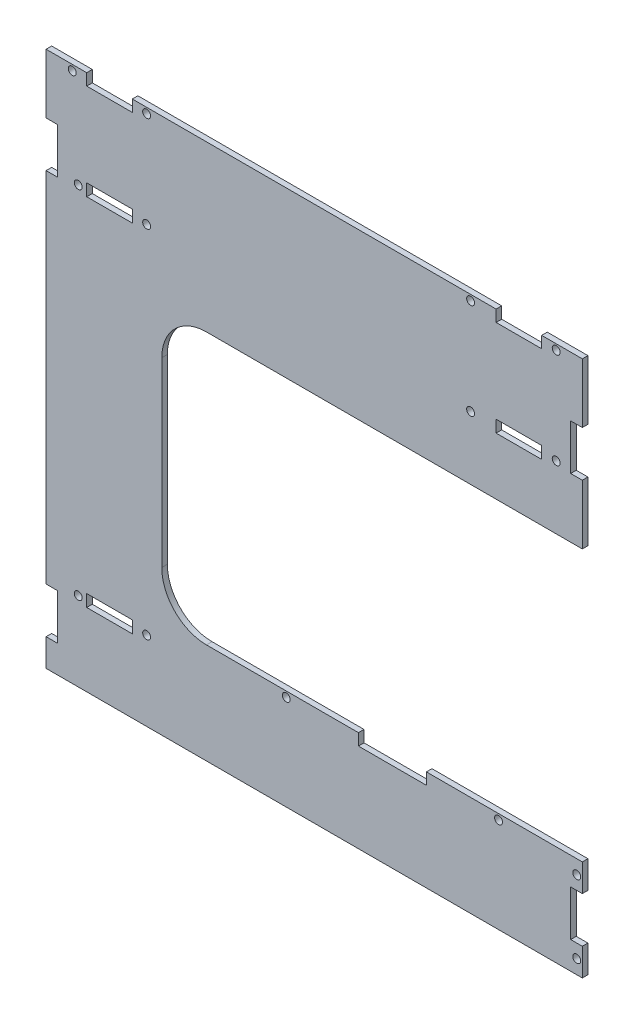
SolidWorks part; units mm, degrees
ref_plane "Front Plane" through (0, 0, 0) normal (0, 0, 1) x (1, 0, 0)
ref_plane "Top Plane" through (0, 0, 0) normal (0, 1, 0) x (1, 0, 0)
ref_plane "Right Plane" through (0, 0, 0) normal (1, 0, 0) x (0, 0, -1)
imported_body "Stock-H_bot printer-1"
sketch "Sketch1" plane through (0, 0, -304.8) normal (0, 0, -1) x (-1, 0, 0)
  line L0 (-281.45, 243.9758) -> (-256.05, 243.9758) construction
  line L1 (-281.45, 250.3258) -> (-281.45, 243.9758) construction
  line L2 (-256.05, 243.9758) -> (-256.05, 250.3258) construction
  line L3 (-256.05, 250.3258) -> (-281.45, 250.3258) construction
  line L4 (-281.45, 243.9758) -> (-256.05, 243.9758)
  line L5 (-281.45, 250.3258) -> (-281.45, 243.9758)
  line L6 (-256.05, 243.9758) -> (-256.05, 250.3258)
  line L7 (-256.05, 250.3258) -> (-281.45, 250.3258)
  line L8 (-48.75, 250.3258) -> (-48.75, 243.9758) construction
  line L9 (-23.35, 250.3258) -> (-48.75, 250.3258) construction
  line L10 (-23.35, 243.9758) -> (-23.35, 250.3258) construction
  line L11 (-48.75, 243.9758) -> (-23.35, 243.9758) construction
  line L12 (-48.75, 250.3258) -> (-48.75, 243.9758)
  line L13 (-23.35, 250.3258) -> (-48.75, 250.3258)
  line L14 (-23.35, 243.9758) -> (-23.35, 250.3258)
  line L15 (-48.75, 243.9758) -> (-23.35, 243.9758)
  line L16 (-48.75, 41.7902) -> (-23.35, 41.7902) construction
  line L17 (-23.35, 41.7902) -> (-23.35, 48.1402) construction
  line L18 (-23.35, 48.1402) -> (-48.75, 48.1402) construction
  line L19 (-48.75, 48.1402) -> (-48.75, 41.7902) construction
  line L20 (-48.75, 48.1402) -> (-48.75, 41.7902)
  line L21 (-23.35, 48.1402) -> (-48.75, 48.1402)
  line L22 (-23.35, 41.7902) -> (-23.35, 48.1402)
  line L23 (-48.75, 41.7902) -> (-23.35, 41.7902)
  line L24 (-304.8, 41.529) -> (-298.196, 41.529)
  line L25 (-298.196, 41.529) -> (-298.196, 15.621)
  line L26 (-298.196, 15.621) -> (-304.8, 15.621)
  line L27 (-304.8, 41.275) -> (-304.8, 41.529)
  line L28 (-304.8, 15.875) -> (-304.8, 15.621)
  line L29 (-177.546, 57.15) -> (-177.546, 50.546)
  line L30 (-177.546, 50.546) -> (-216.154, 50.546)
  line L31 (-216.154, 50.546) -> (-216.154, 57.15)
  line L32 (-216.154, 57.15) -> (-215.9, 57.15)
  line L33 (-177.8, 57.15) -> (-177.546, 57.15)
  line L34 (-49.004, 41.5362) -> (-23.096, 41.5362)
  line L35 (-23.096, 41.5362) -> (-23.096, 48.3942)
  line L36 (-304.8, 41.275) -> (-298.45, 41.275)
  line L37 (-298.45, 41.275) -> (-298.45, 15.875)
  line L38 (-298.45, 15.875) -> (-304.8, 15.875)
  line L39 (-304.8, 15.875) -> (-304.8, 0)
  line L40 (-304.8, 0) -> (0, 0)
  line L41 (0, 0) -> (0, 15.875)
  line L42 (0, 15.875) -> (-6.35, 15.875)
  line L43 (-6.35, 15.875) -> (-6.35, 41.275)
  line L44 (-6.35, 41.275) -> (0, 41.275)
  line L45 (0, 41.275) -> (0, 245.3)
  line L46 (0, 245.3) -> (-6.35, 245.3)
  line L47 (-6.35, 245.3) -> (-6.35, 270.7)
  line L48 (-6.35, 270.7) -> (0, 270.7)
  line L49 (0, 270.7) -> (0, 304.8)
  line L50 (0, 304.8) -> (-23.35, 304.8)
  line L51 (-23.35, 304.8) -> (-23.35, 298.45)
  line L52 (-23.35, 298.45) -> (-48.75, 298.45)
  line L53 (-48.75, 298.45) -> (-48.75, 304.8)
  line L54 (-48.75, 304.8) -> (-256.05, 304.8)
  line L55 (-256.05, 304.8) -> (-256.05, 298.45)
  line L56 (-256.05, 298.45) -> (-281.45, 298.45)
  line L57 (-281.45, 298.45) -> (-281.45, 304.8)
  line L58 (-281.45, 304.8) -> (-304.8, 304.8)
  line L59 (-304.8, 304.8) -> (-304.8, 270.7)
  line L60 (-304.8, 270.7) -> (-298.45, 270.7)
  line L61 (-298.45, 270.7) -> (-298.45, 245.3)
  line L62 (-298.45, 245.3) -> (-304.8, 245.3)
  line L63 (-304.8, 245.3) -> (-304.8, 211.2)
  line L64 (-304.8, 211.2) -> (-91.15, 211.2)
  line L65 (-65.75, 185.8) -> (-65.75, 82.55)
  line L66 (-91.15, 57.15) -> (-177.8, 57.15)
  line L67 (-177.8, 57.15) -> (-177.8, 50.8)
  line L68 (-177.8, 50.8) -> (-215.9, 50.8)
  line L69 (-215.9, 50.8) -> (-215.9, 57.15)
  line L70 (-215.9, 57.15) -> (-304.8, 57.15)
  line L71 (-304.8, 57.15) -> (-304.8, 41.275)
  line L72 (-304.8, 41.275) -> (-298.45, 41.275)
  line L73 (-298.45, 41.275) -> (-298.45, 15.875)
  line L74 (-298.45, 15.875) -> (-304.8, 15.875)
  line L78 (0, 15.875) -> (-6.35, 15.875)
  line L79 (-6.35, 15.875) -> (-6.35, 41.275)
  line L80 (-6.35, 41.275) -> (0, 41.275)
  line L82 (0, 245.3) -> (-6.35, 245.3)
  line L83 (-6.35, 245.3) -> (-6.35, 270.7)
  line L84 (-6.35, 270.7) -> (0, 270.7)
  line L87 (-23.35, 304.8) -> (-23.35, 298.45)
  line L88 (-23.35, 298.45) -> (-48.75, 298.45)
  line L89 (-48.75, 298.45) -> (-48.75, 304.8)
  line L91 (-256.05, 304.8) -> (-256.05, 298.45)
  line L92 (-256.05, 298.45) -> (-281.45, 298.45)
  line L93 (-281.45, 298.45) -> (-281.45, 304.8)
  line L96 (-304.8, 270.7) -> (-298.45, 270.7)
  line L97 (-298.45, 270.7) -> (-298.45, 245.3)
  line L98 (-298.45, 245.3) -> (-304.8, 245.3)
  line L103 (-177.8, 57.15) -> (-177.8, 50.8)
  line L104 (-177.8, 50.8) -> (-215.9, 50.8)
  line L105 (-215.9, 50.8) -> (-215.9, 57.15)
  line L108 (-23.096, 48.3942) -> (-49.004, 48.3942)
  line L109 (-49.004, 48.3942) -> (-49.004, 41.5362)
  line L110 (-255.796, 250.5798) -> (-281.704, 250.5798)
  line L111 (-281.704, 250.5798) -> (-281.704, 243.7218)
  line L112 (-281.704, 243.7218) -> (-255.796, 243.7218)
  line L113 (-255.796, 243.7218) -> (-255.796, 250.5798)
  line L114 (-49.004, 243.7218) -> (-23.096, 243.7218)
  line L115 (-23.096, 243.7218) -> (-23.096, 250.5798)
  line L116 (-23.096, 250.5798) -> (-49.004, 250.5798)
  line L117 (-49.004, 250.5798) -> (-49.004, 243.7218)
  line L118 (-304.8, 270.954) -> (-298.196, 270.954)
  line L119 (-298.196, 270.954) -> (-298.196, 245.046)
  line L120 (-298.196, 245.046) -> (-304.8, 245.046)
  line L121 (-304.8, 270.954) -> (-304.8, 270.7)
  line L122 (-304.8, 245.3) -> (-304.8, 245.046)
  line L123 (-255.796, 304.8) -> (-255.796, 298.196)
  line L124 (-255.796, 298.196) -> (-281.704, 298.196)
  line L125 (-281.704, 298.196) -> (-281.704, 304.8)
  line L126 (-281.704, 304.8) -> (-281.45, 304.8)
  line L127 (-255.796, 304.8) -> (-256.05, 304.8)
  line L128 (-23.096, 304.8) -> (-23.096, 298.196)
  line L129 (-23.096, 298.196) -> (-49.004, 298.196)
  line L130 (-49.004, 298.196) -> (-49.004, 304.8)
  line L131 (-49.004, 304.8) -> (-48.75, 304.8)
  line L132 (-23.35, 304.8) -> (-23.096, 304.8)
  line L133 (0, 245.046) -> (-6.604, 245.046)
  line L134 (-6.604, 245.046) -> (-6.604, 270.954)
  line L135 (-6.604, 270.954) -> (0, 270.954)
  line L136 (0, 270.954) -> (0, 270.7)
  line L137 (0, 245.3) -> (0, 245.046)
  line L138 (-0.254, 15.621) -> (0, 15.621)
  line L139 (-0.254, 15.621) -> (-6.604, 15.621)
  line L140 (-6.604, 15.621) -> (-6.604, 41.529)
  line L141 (-6.604, 41.529) -> (0, 41.529)
  line L142 (0, 41.529) -> (0, 41.275)
  line L143 (0, 0) -> (0, 15.875) construction
  line L144 (-0.254, 0) -> (-0.254, 15.621) construction
  line L145 (0, 0) -> (0, 15.875) construction
  line L146 (0, 15.621) -> (0, 15.875)
  circle A0 centre (-289.95, 301.625) radius 1.25 construction
  circle A1 centre (-241.3, 301.625) radius 1.25 construction
  arc A2 (-65.75, 185.8) -> (-91.15, 211.2) centre (-91.15, 185.8) ccw
  arc A3 (-91.15, 57.15) -> (-65.75, 82.55) centre (-91.15, 82.55) ccw
  circle A6 centre (-241.3, 247.1508) radius 1.25 construction
  circle A7 centre (-289.95, 247.1508) radius 1.25 construction
  circle A8 centre (-289.95, 301.625) radius 1.25
  circle A9 centre (-241.3, 301.625) radius 1.25
  circle A10 centre (-241.3, 247.1508) radius 1.25
  circle A11 centre (-289.95, 247.1508) radius 1.25
  circle A12 centre (-14.85, 301.625) radius 1.25 construction
  circle A13 centre (-57.15, 301.625) radius 1.25 construction
  circle A14 centre (-18.27, 247.1508) radius 1.25 construction
  circle A15 centre (-57.15, 247.1508) radius 1.25 construction
  circle A16 centre (-14.85, 301.625) radius 1.25
  circle A17 centre (-57.15, 301.625) radius 1.25
  circle A18 centre (-18.27, 247.1508) radius 1.25
  circle A19 centre (-57.15, 247.1508) radius 1.25
  circle A20 centre (-301.625, 7.9375) radius 1.25 construction
  circle A21 centre (-301.625, 49.2125) radius 1.25 construction
  circle A22 centre (-257.175, 53.975) radius 1.25 construction
  circle A23 centre (-136.525, 53.975) radius 1.25 construction
  circle A24 centre (-18.27, 44.9652) radius 1.25 construction
  circle A25 centre (-57.15, 44.9652) radius 1.25 construction
  circle A26 centre (-57.15, 44.9652) radius 1.25
  circle A27 centre (-18.27, 44.9652) radius 1.25
  circle A28 centre (-136.525, 53.975) radius 1.25
  circle A29 centre (-257.175, 53.975) radius 1.25
  circle A30 centre (-301.625, 49.2125) radius 1.25
  circle A31 centre (-301.625, 7.9375) radius 1.25
  circle A32 centre (-289.95, 301.625) radius 2.25
  circle A33 centre (-241.3, 301.625) radius 2.25
  circle A34 centre (-289.95, 247.1508) radius 2.25
  circle A35 centre (-241.3, 247.1508) radius 2.25
  circle A36 centre (-57.15, 301.625) radius 2.25
  circle A37 centre (-14.85, 301.625) radius 2.25
  circle A38 centre (-57.15, 247.1508) radius 2.25
  circle A39 centre (-18.27, 247.1508) radius 2.25
  circle A40 centre (-57.15, 44.9652) radius 2.25
  circle A41 centre (-18.27, 44.9652) radius 2.25
  circle A42 centre (-136.525, 53.975) radius 2.25
  circle A43 centre (-257.175, 53.975) radius 2.25
  circle A44 centre (-301.625, 49.2125) radius 2.25
  circle A45 centre (-301.625, 7.9375) radius 2.25
  dimension "D11" = 4.5
  dimension "D1" = 0
  dimension "D2" = 0.254
  dimension "D3" = 0.254
  dimension "D4" = 0.254
  dimension "D5" = 0.254
  dimension "D6" = 0.254
  dimension "D7" = 0.254
  dimension "D8" = 0.254
  dimension "D9" = 0.254
  dimension "D10" = 0.254
extrude "Cut-Extrude1" cut sketch "Sketch1" against normal through all
